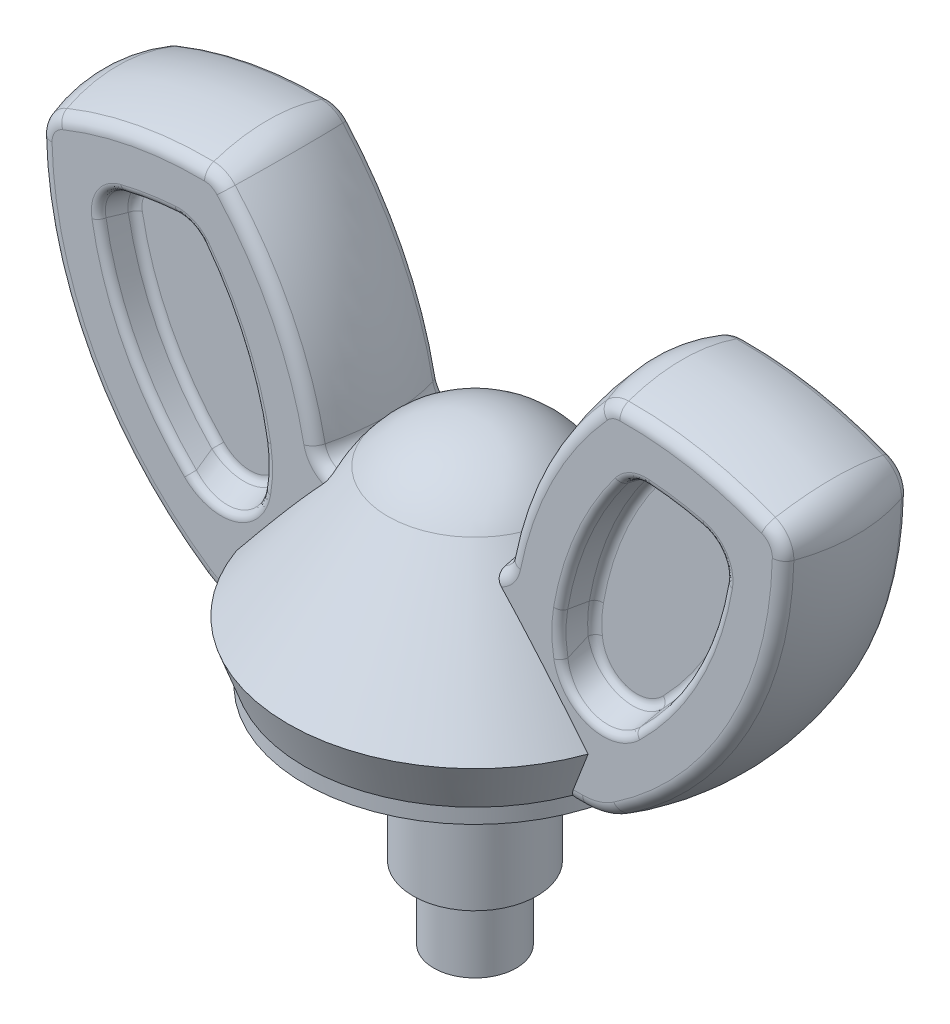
SolidWorks part; units mm, degrees
ref_plane "Front Plane" through (0, 0, 0) normal (0, 0, 1) x (1, 0, 0)
ref_plane "Top Plane" through (0, 0, 0) normal (0, 1, 0) x (1, 0, 0)
ref_plane "Right Plane" through (0, 0, 0) normal (1, 0, 0) x (0, 0, -1)
sketch "Sketch1" plane through (0, 0, 0) normal (0, 0, 1) x (1, 0, 0)
  line L0 (0, 10.7344) -> (0, 0) construction
  line L5 (4.826, 0) -> (-4.826, 0)
  line L6 (2.413, 5.08) -> (-2.413, 5.08)
  arc A11 (-2.413, 5.08) -> (-5.3975, 10.9034) centre (-13.1787, 3.2391) ccw
  arc A13 (-5.3975, 10.9034) -> (-10.795, 9.8298) centre (-6.0342, 0) ccw
  arc A24 (-10.795, 9.8298) -> (-6.0486, 0.3742) centre (0, 9.3295) ccw
  arc A26 (-4.826, 0) -> (-6.0486, 0.3742) centre (-4.826, 2.1844) cw
  arc A29 (4.826, 0) -> (6.0486, 0.3742) centre (4.826, 2.1844) ccw
  arc A34 (10.795, 9.8298) -> (6.0486, 0.3742) centre (0, 9.3295) cw
  arc A36 (5.3975, 10.9034) -> (10.795, 9.8298) centre (6.0342, 0) cw
  arc A37 (2.413, 5.08) -> (5.3975, 10.9034) centre (13.1787, 3.2391) cw
  point P19 (0, 0)
  point P27 (0, 5.08)
  point P29 (0, 5.08)
  point P44 (0, 5.08)
  dimension "D2" = 2.1844
  dimension "D1" = 5.3975
  dimension "D3" = 9.8298
  dimension "D4" = 10.922
  dimension "B" = 10.922
  dimension "A" = 21.59
  dimension "E" = 9.652
  dimension "G" = 5.08
  dimension "D5" = 4.826
extrude "Extrude1" add sketch "Sketch1" along normal mid plane 3.556
fillet "Fillet4" radius 1.0922 4 edges at (10.795, 9.8298, 0) (5.3975, 10.9034, 0) (-5.3975, 10.9034, 0) (-10.795, 9.8298, 0)
sketch "Sketch2" plane through (0, 0, 1.778) normal (0, 0, 1) x (1, 0, 0)
  line L0 (0, 0) -> (0, 12.8329) construction
  line L1 (-4.826, 0) -> (4.826, 0) construction
  arc A10 (-4.1864, 4.7767) -> (-5.0416, 1.8652) centre (-7.5893, 4.1949) cw
  arc A11 (4.1864, 4.7767) -> (6.2055, 9.1212) centre (13.1787, 3.2391) cw
  arc A12 (6.2055, 9.1212) -> (8.9805, 8.634) centre (6.0342, 0) cw
  arc A13 (8.9805, 8.634) -> (5.0416, 1.8652) centre (0, 9.3295) cw
  arc A14 (4.1864, 4.7767) -> (5.0416, 1.8652) centre (7.5893, 4.1949) ccw
  arc A15 (-8.9805, 8.634) -> (-5.0416, 1.8652) centre (0, 9.3295) ccw
  arc A16 (-6.2055, 9.1212) -> (-8.9805, 8.634) centre (-6.0342, 0) ccw
  arc A17 (-4.1864, 4.7767) -> (-6.2055, 9.1212) centre (-13.1787, 3.2391) ccw
  arc A18 (-8.9805, 8.634) -> (-5.0416, 1.8652) centre (0, 9.3295) ccw
  arc A19 (-6.2055, 9.1212) -> (-8.9805, 8.634) centre (-6.0342, 0) ccw
  arc A20 (-4.1864, 4.7767) -> (-6.2055, 9.1212) centre (-13.1787, 3.2391) ccw
  dimension "D1" = 1.7992
extrude "Cut-Extrude1" cut sketch "Sketch2" against normal blind 0.889 draft 10
fillet "Fillet1" radius 0.889 4 edges
fillet "Fillet6" radius 1.2446 2 edges
fillet "Fillet5" radius 0.3641 2 edges at (2.413, 5.08, 0) (-2.413, 5.08, 0)
fillet "Fillet3" radius 0.2223 28 edges at (7.4585, 9.011, 1.778) (7.4007, 8.8613, 0.889) (6.4621, 8.9114, 0.889) (8.6146, 8.3041, 0.889) (7.8855, 5.3103, 0.889) (4.2988, 4.3764, 0.889) (6.1282, 8.9579, 1.778) (8.7221, 8.5339, 1.778) (7.9776, 5.1471, 1.778) (4.1377, 4.1292, 1.778) (-4.2988, 4.3764, 0.889) (-7.8855, 5.3103, 0.889) (-8.5332, 8.4279, 0.889) (-7.4007, 8.8613, 0.889) (-6.1942, 8.7899, 0.889) (-4.1377, 4.1292, 1.778) (-7.9776, 5.1471, 1.778) (-8.7866, 8.4358, 1.778) (-7.4585, 9.011, 1.778) (-6.3795, 9.0717, 1.778) (4.9351, 6.7652, 0.889) (4.81, 6.8709, 1.778) (-4.9351, 6.7652, 0.889) (-4.81, 6.8709, 1.778) (4.9742, 2.938, 0.889) (5.0791, 2.5366, 1.778) (-5.2102, 2.8514, 0.889) (-5.0131, 2.5568, 1.778)
mirror "Mirror1" about plane through (0, 0, 0) normal (0, 0, 1) of "Fillet6", "Fillet3", "Fillet1", "Cut-Extrude1"
sketch "Sketch4" plane through (0, 0, 0) normal (1, 0, 0) x (0, 0, -1)
  line L1 (-1.778, 5.334) -> (1.778, 5.334)
  line L2 (-1.778, 4.4704) -> (-1.778, 5.334)
  line L4 (1.778, 0.3742) -> (1.778, 9.0918) construction
  line L6 (-1.778, 9.0918) -> (-1.778, 0.3742) construction
  line L7 (0, 5.715) -> (0, 0.381) construction
  line L9 (1.778, 4.4704) -> (1.778, 5.334)
  line L10 (-1.778, 5.08) -> (1.778, 5.08) construction
  arc A0 (-1.524, 4.826) -> (-1.778, 4.4704) centre (-1.4021, 4.4704) ccw
  arc A1 (1.524, 4.826) -> (-1.524, 4.826) centre (0, 0.381) ccw
  arc A2 (1.524, 4.826) -> (1.778, 4.4704) centre (1.4021, 4.4704) cw
  point P8 (0, 5.08)
  dimension "D1" = 0.254
  dimension "D2" = 0.254
  dimension "D3" = 0.254
sketch3d "3DSketch1"
  line L2 (-2.1102, 5.08, 1.778) -> (2.1102, 5.08, 1.778)
  line L3 (4.826, 0, 1.778) -> (-4.826, 0, 1.778)
  line L4 (-2.1102, 5.08, 1.778) -> (2.1102, 5.08, 1.778)
  line L5 (4.826, 0, 1.778) -> (-4.826, 0, 1.778)
  arc A15 (10.804, 9.0918, 1.778) -> (6.0486, 0.3742, 1.778) centre (0, 9.3295, 1.778) ccw
  arc A16 (10.1207, 10.1287, 1.778) -> (10.804, 9.0918, 1.778) centre (9.712, 9.1158, 1.778) ccw
  arc A17 (5.8682, 10.9207, 1.778) -> (10.1207, 10.1287, 1.778) centre (6.0342, 0, 1.778) ccw
  arc A18 (5.0743, 10.5608, 1.778) -> (5.8682, 10.9207, 1.778) centre (5.8848, 9.8287, 1.778) ccw
  arc A19 (2.4672, 5.3729, 1.778) -> (5.0743, 10.5608, 1.778) centre (13.1787, 3.2391, 1.778) ccw
  arc A20 (2.1102, 5.08, 1.778) -> (2.4672, 5.3729, 1.778) centre (2.1102, 5.4441, 1.778) ccw
  arc A21 (2.1102, 5.08, 1.778) -> (2.4672, 5.3729, 1.778) centre (2.1102, 5.4441, 1.778) ccw
  arc A22 (-5.0743, 10.5608, 1.778) -> (-2.4672, 5.3729, 1.778) centre (-13.1787, 3.2391, 1.778) ccw
  arc A23 (-5.8682, 10.9207, 1.778) -> (-5.0743, 10.5608, 1.778) centre (-5.8848, 9.8287, 1.778) ccw
  arc A24 (-10.1207, 10.1287, 1.778) -> (-5.8682, 10.9207, 1.778) centre (-6.0342, 0, 1.778) ccw
  arc A25 (-10.804, 9.0918, 1.778) -> (-10.1207, 10.1287, 1.778) centre (-9.712, 9.1158, 1.778) ccw
  arc A26 (-6.0486, 0.3742, 1.778) -> (-10.804, 9.0918, 1.778) centre (0, 9.3295, 1.778) ccw
  arc A27 (-4.826, 0, 1.778) -> (-6.0486, 0.3742, 1.778) centre (-4.826, 2.1844, 1.778) ccw
  arc A28 (6.0486, 0.3742, 1.778) -> (4.826, 0, 1.778) centre (4.826, 2.1844, 1.778) ccw
  arc A29 (10.804, 9.0918, 1.778) -> (6.0486, 0.3742, 1.778) centre (0, 9.3295, 1.778) ccw
  arc A30 (10.1207, 10.1287, 1.778) -> (10.804, 9.0918, 1.778) centre (9.712, 9.1158, 1.778) ccw
  arc A31 (5.8682, 10.9207, 1.778) -> (10.1207, 10.1287, 1.778) centre (6.0342, 0, 1.778) ccw
  arc A32 (5.0743, 10.5608, 1.778) -> (5.8682, 10.9207, 1.778) centre (5.8848, 9.8287, 1.778) ccw
  arc A33 (2.4672, 5.3729, 1.778) -> (5.0743, 10.5608, 1.778) centre (13.1787, 3.2391, 1.778) ccw
  arc A34 (-2.4672, 5.3729, 1.778) -> (-2.1102, 5.08, 1.778) centre (-2.1102, 5.4441, 1.778) ccw
  arc A35 (-2.4672, 5.3729, 1.778) -> (-2.1102, 5.08, 1.778) centre (-2.1102, 5.4441, 1.778) ccw
  arc A36 (-5.0743, 10.5608, 1.778) -> (-2.4672, 5.3729, 1.778) centre (-13.1787, 3.2391, 1.778) ccw
  arc A37 (-5.8682, 10.9207, 1.778) -> (-5.0743, 10.5608, 1.778) centre (-5.8848, 9.8287, 1.778) ccw
  arc A38 (-10.1207, 10.1287, 1.778) -> (-5.8682, 10.9207, 1.778) centre (-6.0342, 0, 1.778) ccw
  arc A39 (-10.804, 9.0918, 1.778) -> (-10.1207, 10.1287, 1.778) centre (-9.712, 9.1158, 1.778) ccw
  arc A40 (-6.0486, 0.3742, 1.778) -> (-10.804, 9.0918, 1.778) centre (0, 9.3295, 1.778) ccw
  arc A41 (-4.826, 0, 1.778) -> (-6.0486, 0.3742, 1.778) centre (-4.826, 2.1844, 1.778) ccw
  arc A42 (6.0486, 0.3742, 1.778) -> (4.826, 0, 1.778) centre (4.826, 2.1844, 1.778) ccw
  point P3 (2.1102, 5.4441, 2.1421)
  point P5 (2.1102, 5.4441, 2.1421)
  point P11 (-2.1102, 5.4441, 2.1421)
  point P13 (-2.1102, 5.4441, 2.1421)
  point P43 (0, 9.3295, -9.0286)
  point P46 (9.712, 9.1158, 0.6858)
  point P48 (6.0342, 0, -9.144)
  point P50 (5.8848, 9.8287, 0.6858)
  point P52 (13.1787, 3.2391, -9.144)
  point P58 (-13.1787, 3.2391, -9.144)
  point P60 (-5.8848, 9.8287, 0.6858)
  point P62 (-6.0342, 0, -9.144)
  point P64 (-9.712, 9.1158, 0.6858)
  point P66 (0, 9.3295, -9.0286)
  point P68 (-4.826, 2.1844, -0.4064)
  point P70 (4.826, 2.1844, -0.4064)
  point P71 (0, 9.3295, -9.0286)
  point P72 (9.712, 9.1158, 0.6858)
  point P73 (6.0342, 0, -9.144)
  point P74 (5.8848, 9.8287, 0.6858)
  point P75 (13.1787, 3.2391, -9.144)
  point P78 (-13.1787, 3.2391, -9.144)
  point P79 (-5.8848, 9.8287, 0.6858)
  point P80 (-6.0342, 0, -9.144)
  point P81 (-9.712, 9.1158, 0.6858)
  point P82 (0, 9.3295, -9.0286)
  point P83 (-4.826, 2.1844, -0.4064)
  point P84 (4.826, 2.1844, -0.4064)
  dimension "D1" = 0
sweep "Cut-Sweep2" cut profiles "Sketch4" path "3DSketch1"
sketch "Sketch3" plane through (0, 0, 0) normal (0, 0, 1) x (1, 0, 0)
  line L0 (0, 6.5903) -> (0, -11.3525) construction
  line L1 (1.7526, 0) -> (4.826, 0)
  line L2 (5.2882, 1.6933) -> (2.4672, 5.3729)
  line L4 (1.7526, 0) -> (1.7526, -6.35)
  line L5 (1.7526, -6.35) -> (0, -6.35)
  line L6 (4.826, 0) -> (4.826, 0.4233)
  line L7 (0, 6.5903) -> (0, -6.35)
  line L8 (0, 6.5903) -> (-2.4754, 6.5903) construction
  line L9 (4.826, 0.4233) -> (5.2882, 1.6933)
  arc A1 (2.4672, 5.3729) -> (0, 6.5903) centre (0, 3.4814) ccw
  dimension "D2" = 1.27
  dimension "D3" = 9.652
  dimension "d1" = 3.5052
  dimension "D4" = 0.4233
  dimension "L" = 6.35
  dimension "D5" = 20
revolve "Revolve1" add sketch "Sketch3" angle 360 about L0
sketch "Sketch6" plane through (0, 0, 0) normal (0, 0, 1) x (1, 0, 0)
  line L0 (0, 4.5862) -> (0, -10.6597) construction
  line L1 (1.1684, -4.699) -> (2.0066, -4.1121)
  line L2 (2.0066, -4.1121) -> (2.0066, -6.604)
  line L3 (2.0066, -6.604) -> (1.1684, -6.604)
  line L4 (1.1684, -6.604) -> (1.1684, -4.699)
  line L5 (-1.7526, -6.35) -> (1.7526, -6.35) construction
  line L8 (1.7526, -6.35) -> (1.7526, 0) construction
  dimension "D1" = 125
  dimension "D2" = 0.254
  dimension "D3" = 0.254
  dimension "Q" = 1.651
  dimension "P" = 2.3368
revolve "Cut-Revolve11" cut sketch "Sketch6" angle 360 about L0
sketch "Sketch5" plane through (0, 0, 0) normal (0, 0, 1) x (1, 0, 0)
  line L0 (1.7526, -0.0254) -> (1.2802, -0.2982)
  line L1 (1.2802, -0.2982) -> (1.7526, -0.5709)
  line L2 (1.7526, -0.5709) -> (1.7526, -0.0254)
  line L3 (0, 0) -> (0, -7.7715) construction
  line L6 (1.2802, -0.2982) -> (1.2802, -1.0906) construction
  dimension "D1" = 3.5052
  dimension "D2" = 2.5603
  dimension "D3" = 0.0254
  dimension "pitch" = 0.7925
revolve "Cut-Revolve10" [suppressed] cut sketch "Sketch5" angle 360 about L3
pattern_linear "LPattern10" [suppressed] count 8 spacing 0.7925 along (0, -1, 0)
equation "\"D5@Sketch1\" = \"E@Sketch1\" / 2"
equation "\"D1@Sketch1\" = \"A@Sketch1\" / 4"
equation "\"D3@Sketch1\" = \"B@Sketch1\" * 9 /  10"
equation "\"D4@Sketch1\" = \"B@Sketch1\""
equation "\"D2@Sketch1\" = \"D4@Sketch1\" / 5"
equation "\"D1@Cut-Extrude1\" = \"C@Extrude1\" / 4"
equation "\"D1@Fillet1\" = \"D1@Cut-Extrude1\""
equation "\"D1@Fillet3\" = \"D1@Cut-Extrude1\" / 4"
equation "\"D2@Sketch3\" = \"G@Sketch1\" / 4"
equation "\"D3@Sketch3\" = \"E@Sketch1\""
equation "\"D1@Sketch4\" = \"C@Extrude1\" / 14"
equation "\"D1@Sketch5\" = \"d1@Sketch3\""
equation "\"D2@Sketch5\" = \"THD_MINOR@Cosmetic Thread1\""
equation "\"D3@LPattern10\" = \"pitch@Sketch5\""
equation "\"D1@LPattern10\" = \"L@Sketch3\" / \"D3@LPattern10\""
equation "\"D1@Cosmetic Thread1\" = \"L@Sketch3\""
equation "\"D2@Sketch4\" = \"D1@Sketch4\""
equation "\"D4@Sketch3\" = \"D2@Sketch3\" / 3"
equation "\"D1@Fillet4\" = \"D2@Sketch1\" /2"
equation "\"D1@Sketch2\" = \"D1@Sketch1\" / 3"
equation "\"D1@Fillet5\" = \"D1@Fillet4\" / 3"
equation "\"D1@Fillet6\" = \"D1@Fillet1\" * 1.4"
